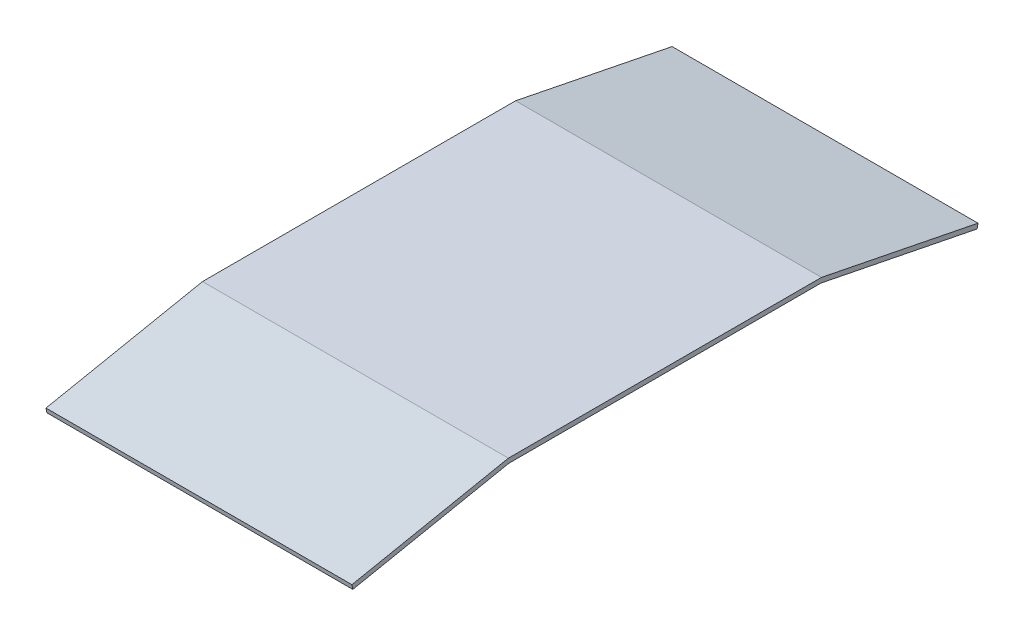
SolidWorks part; units mm, degrees
ref_plane "Plan de face" through (0, 0, 0) normal (0, 0, 1) x (1, 0, 0)
ref_plane "Plan de dessus" through (0, 0, 0) normal (0, 1, 0) x (1, 0, 0)
ref_plane "Plan de droite" through (0, 0, 0) normal (1, 0, 0) x (0, 0, -1)
sketch "Esquisse1" plane through (0, 0, 0) normal (1, 0, 0) x (0, 0, -1)
  line L0 (230.4571, 0) -> (-209.2231, 0) construction
  line L1 (0, -4.7058) -> (0, 67.2467) construction
  line L2 (100, -4.7058) -> (100, 67.2467) construction
  line L3 (200, -4.7058) -> (200, 72.7814) construction
  line L4 (230.4571, 20) -> (-209.2231, 20) construction
  line L5 (230.4571, 23) -> (-3.8441, 23) construction
  line L6 (100, 20) -> (200, 0) construction
  line L7 (200, 0) -> (202.152, 10.7602) construction
  line L8 (95.7455, 23.9103) -> (200.5883, 2.9417) construction
  line L9 (100, 20) -> (200, 0)
  line L10 (200, 0) -> (200.5883, 2.9417)
  line L11 (100.2971, 23) -> (200.5883, 2.9417)
  line L12 (-200, 0) -> (-200.5883, 2.9417)
  line L13 (-100.2971, 23) -> (-200.5883, 2.9417)
  line L14 (-100, 20) -> (-200, 0)
  line L15 (-100.2971, 23) -> (100.2971, 23)
  line L16 (-100, 20) -> (100, 20)
  dimension "D1" = 100
  dimension "D2" = 100
  dimension "D3" = 20
  dimension "D4" = 3
  dimension "D5" = 90
  dimension "D6" = 3
extrude "Boss.-Extru.1" add sketch "Esquisse1" along normal blind 196
